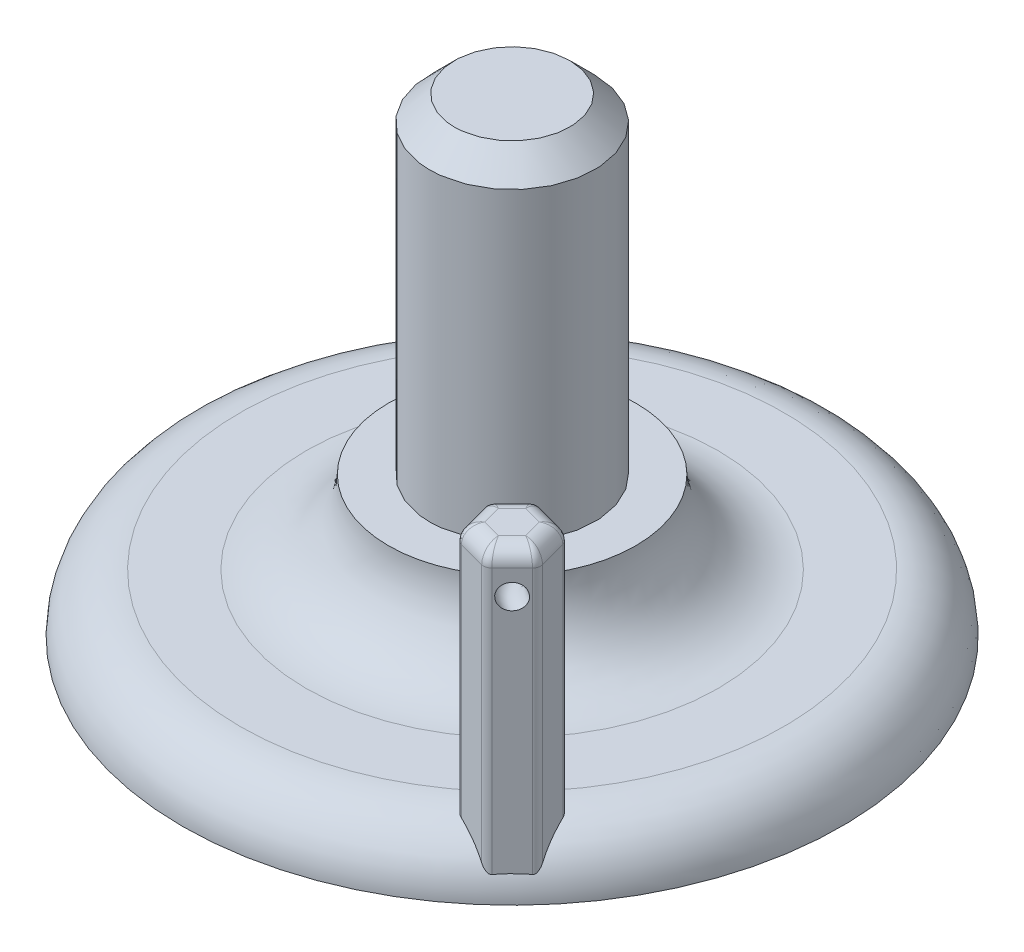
SolidWorks part; units mm, degrees
ref_plane "Front Plane" through (0, 0, 0) normal (0, 0, 1) x (1, 0, 0)
ref_plane "Top Plane" through (0, 0, 0) normal (0, 1, 0) x (1, 0, 0)
ref_plane "Right Plane" through (0, 0, 0) normal (1, 0, 0) x (0, 0, -1)
sketch "Sketch2" plane through (0, 0, 0) normal (0, 1, 0) x (1, 0, 0)
  circle A0 centre (0, 0) radius 40
  dimension "D1" = 80
extrude "Boss-Extrude1" add sketch "Sketch2" along normal blind 7
sketch "Sketch3" plane through (0, 7, 0) normal (0, 1, 0) x (1, 0, 0)
  circle A0 centre (0, 0) radius 15
  dimension "D1" = 30
extrude "Boss-Extrude2" add sketch "Sketch3" along normal blind 10
sketch "Sketch4" plane through (0, 17, 0) normal (0, 1, 0) x (1, 0, 0)
  circle A0 centre (0, 0) radius 10
  dimension "D1" = 20
extrude "Boss-Extrude3" add sketch "Sketch4" along normal blind 40
sketch "Sketch5" plane through (0, 7, 0) normal (0, 1, 0) x (1, 0, 0)
  line L0 (25, 0) -> (25, -25) construction
  line L1 (25, -25) -> (0, -25) construction
  line L2 (0, 0) -> (22.1557, -22.1557) construction
  line L3 (26.2021, -29.4864) -> (29.4864, -26.2021)
  line L4 (29.4864, -26.2021) -> (28.2843, -21.7157)
  line L5 (28.2843, -21.7157) -> (23.7979, -20.5136)
  line L6 (23.7979, -20.5136) -> (20.5136, -23.7979)
  line L7 (20.5136, -23.7979) -> (21.7157, -28.2843)
  line L8 (21.7157, -28.2843) -> (26.2021, -29.4864)
  circle A0 centre (0, 0) radius 25 construction
  circle A1 centre (25, -25) radius 4.6447 construction
  circle A2 centre (0, 0) radius 40 construction
  dimension "D1" = 50
  dimension "D2" = 90
extrude "Boss-Extrude4" add sketch "Sketch5" along normal blind 30 contours L4 L5 L6 L7 L8 L3
chamfer "Chamfer1" distance 3 angle 45 1 edges at (0, 57, 10)
fillet "Fillet2" radius 10 1 edges at (0, 7, 15)
fillet "Fillet3" radius 1 1 edges at (26.2021, 22, 29.4864)
fillet "Fillet4" radius 1 5 edges at (23.7979, 22, 20.5136) (20.5136, 22, 23.7979) (21.7157, 22, 28.2843) (29.4864, 22, 26.2021) (28.2843, 22, 21.7157)
fillet "Fillet5" radius 2 12 edges at (28.1749, 37, 21.8251) (28.8853, 37, 23.9589) (29.337, 37, 26.1621) (27.8443, 37, 27.8443) (26.1621, 37, 29.337) (23.9589, 37, 28.8853) (21.8251, 37, 28.1749) (21.1147, 37, 26.0411) (20.663, 37, 23.8379) (22.1557, 37, 22.1557) (23.8379, 37, 20.663) (26.0411, 37, 21.1147)
fillet "Fillet6" radius 7 1 edges at (0, 7, 40)
ref_plane "Plane1" through (0, 32, 0) normal (0, 1, 0) x (1, 0, 0)
sketch "Sketch7" plane through (0, 32, 0) normal (0, 1, 0) x (1, 0, 0)
  line L5 (26.0411, -21.1147) -> (23.5605, -25.3857) construction
  line L7 (23.5605, -25.3857) -> (27.8443, -27.8443) construction
  line L8 (29.0781, -26.6104) -> (26.6104, -29.0781) construction
  line L9 (24.3556, -20.663) -> (27.7266, -21.5663) construction
  spline S0 degree 2 poles (26.0411, -21.1147) (23.5605, -25.3857) (27.8443, -27.8443) knots 0 0 0 1 1 1
  point P6 (26.0411, -21.1147)
sketch "Sketch8" plane through (27.8443, 0, 27.8443) normal (0.7071, 0, 0.7071) x (0.7071, 0, -0.7071)
  circle A0 centre (0, 32) radius 1.5
  dimension "D1" = 3
sweep "Cut-Sweep1" cut profiles "Sketch8" path "Sketch7"
shell "Shell3" thickness 1.7
